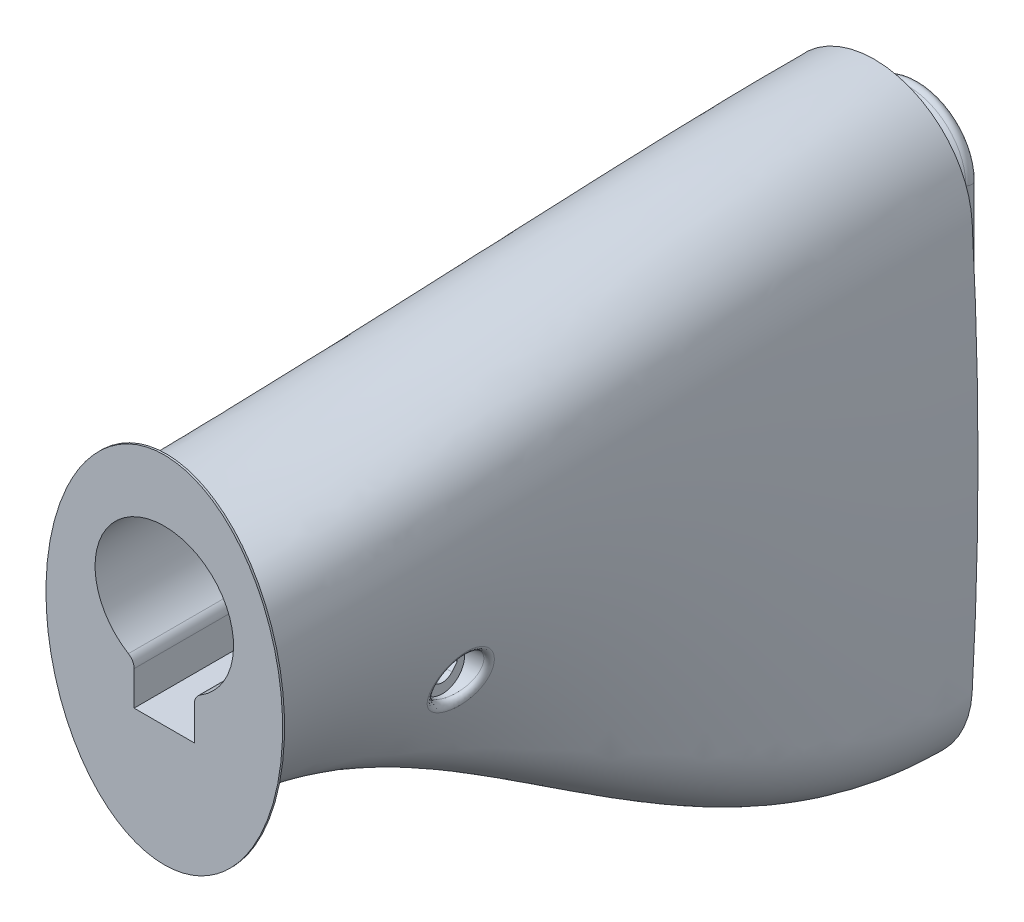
SolidWorks part; units mm, degrees
ref_plane "Front Plane" through (0, 0, 0) normal (0, 0, 1) x (1, 0, 0)
ref_plane "Top Plane" through (0, 0, 0) normal (0, 1, 0) x (1, 0, 0)
ref_plane "Right Plane" through (0, 0, 0) normal (1, 0, 0) x (0, 0, -1)
sketch "Sketch1" plane through (0, 0, 0) normal (0, 0, 1) x (1, 0, 0)
  line L0 (0, 37.2523) -> (0, -28.9777) construction
  line L1 (-22.225, 1.7278) -> (-22.225, 17.909) construction
  arc A0 (-14.2875, 13.501) -> (14.2875, 13.501) centre (0, -21.8186) cw
  arc A1 (-14.2875, 13.501) -> (-22.225, 1.7278) centre (-9.525, 1.7278) ccw
  arc A2 (14.2875, 13.501) -> (22.225, 1.7278) centre (9.525, 1.7278) cw
  arc A3 (-9.9123, -33.3395) -> (9.9123, -33.3395) centre (0, -25.4) ccw
  arc A4 (-22.225, 1.7278) -> (-9.9123, -33.3395) centre (33.8684, 1.7278) ccw
  arc A5 (22.225, 1.7278) -> (9.9123, -33.3395) centre (-33.8684, 1.7278) cw
  dimension "D1" = 12.7
  dimension "D2" = 38.1
  dimension "D3" = 25.4
  dimension "D4" = 44.45
  dimension "D5" = 21.8186
ref_plane "Plane1" through (0, 0, -152.4) normal (0, 0, -1) x (-1, 0, 0)
sketch "Sketch2" plane through (0, 0, -152.4) normal (0, 0, -1) x (-1, 0, 0)
  line L0 (0, 200037.2523) -> (0, -200028.9777) construction
  line L1 (0, 25.4) -> (0, -101.6) construction
  line L2 (-22.225, -38.1) -> (22.225, -38.1) construction
  line L3 (-20.9709, 5.5991) -> (-20.9709, -81.7991) construction
  arc A6 (20.9709, 5.5991) -> (14.2875, 19.7925) centre (0, 4.3945) ccw
  arc A7 (20.9709, -81.7991) -> (20.9709, 5.5991) centre (-739.775, -38.1) ccw
  arc A8 (-20.9709, -81.7991) -> (20.9709, -81.7991) centre (0, -80.5945) ccw
  arc A9 (-20.9709, 5.5991) -> (-20.9709, -81.7991) centre (739.775, -38.1) ccw
  arc A10 (-14.2875, 19.7925) -> (-20.9709, 5.5991) centre (0, 4.3945) ccw
  arc A11 (14.2875, 19.7925) -> (-14.2875, 19.7925) centre (0, 4.3945) ccw
  dimension "D1" = 25.4
  dimension "D2" = 762
  dimension "D4" = 127
  dimension "D5" = 44.45
loft "Loft1" add profiles "Sketch1", "Sketch2"
sketch "Sketch3" plane through (0, 0, 0) normal (0, 0, 1) x (1, 0, 0)
  line L0 (-6.477, -13.373) -> (-6.477, -22.225)
  line L1 (-6.477, -22.225) -> (6.477, -22.225)
  line L2 (6.477, -22.225) -> (6.477, -13.373)
  line L3 (0, -22.225) -> (0, 0) construction
  arc A0 (6.477, -13.373) -> (-6.477, -13.373) centre (0, 0) ccw
  point P11 (0, 14.859)
  dimension "D2" = 14.859
  dimension "D3" = 12.954
  dimension "D4" = 37.084
extrude "Cut-Extrude1" cut sketch "Sketch3" against normal blind 91.44
sketch "Sketch4" plane through (0, 0, 0) normal (1, 0, 0) x (0, 0, -1)
  line L1 (91.44, -22.225) -> (0, -22.225) construction
  circle A0 centre (45.72, -22.225) radius 25.4
  dimension "D1" = 50.8
extrude "Cut-Extrude2" cut sketch "Sketch4" against normal mid plane 2.54
sketch "Sketch5" plane through (0, 0, 0) normal (1, 0, 0) x (0, 0, -1)
  line L0 (91.44, -22.225) -> (0, -22.225) construction
  line L1 (47.763, -25.7177) -> (48.895, -27.0667)
  line L2 (48.895, -27.0667) -> (48.895, -27.7973)
  line L3 (48.895, -27.7973) -> (47.763, -29.1463)
  line L4 (45.72, -27.432) -> (48.895, -27.432) construction
  arc A0 (47.763, -25.7177) -> (47.763, -29.1463) centre (45.72, -27.432) ccw
  circle A1 centre (45.72, -27.432) radius 2.667 construction
  circle A2 centre (45.72, -22.225) radius 25.4
  circle A3 centre (45.72, -22.225) radius 25.4 construction
  point P2 (45.72, -24.765)
  point P13 (48.387, -27.432)
  dimension "D1" = 5.334
  dimension "D4" = 0.508
  dimension "D2" = 2.54
  dimension "D5" = 100
  dimension "D3" = 0
extrude "Cut-Extrude3" cut sketch "Sketch5" against normal through all both and the other way through all
ref_plane "Plane2" through (13.97, 0, 0) normal (1, 0, 0) x (0, 0, -1)
ref_plane "Plane3" through (-13.97, 0, 0) normal (-1, 0, 0) x (0, 0, 1)
sketch "Sketch6" plane through (13.97, 0, 0) normal (1, 0, 0) x (0, 0, -1)
  circle A0 centre (45.72, -27.432) radius 4.7625
  dimension "D1" = 9.525
extrude "Cut-Extrude4" cut sketch "Sketch6" along normal through all draft 5
sketch "Sketch7" plane through (-13.97, 0, 0) normal (-1, 0, 0) x (0, 0, 1)
  line L1 (-51.2926, -27.432) -> (-48.5063, -32.258)
  line L2 (-48.5063, -32.258) -> (-42.9337, -32.258)
  line L3 (-42.9337, -32.258) -> (-40.1474, -27.432)
  line L4 (-40.1474, -27.432) -> (-42.9337, -22.606)
  line L5 (-42.9337, -22.606) -> (-48.5063, -22.606)
  line L6 (-48.5063, -22.606) -> (-51.2926, -27.432)
  circle A0 centre (-45.72, -27.432) radius 4.826 construction
  dimension "D1" = 9.652
extrude "Cut-Extrude5" cut sketch "Sketch7" along normal through all draft 5
sketch "Sketch8" plane through (0, 0, 0) normal (1, 0, 0) x (0, 0, -1)
  line L0 (91.44, 14.859) -> (0, 14.859)
  line L1 (91.44, 14.859) -> (0, 14.859) construction
  line L2 (0, 0) -> (91.44, 0) construction
  line L3 (91.44, 14.859) -> (106.299, 0)
  line L4 (106.299, 0) -> (91.44, 0)
  line L5 (91.44, 14.859) -> (91.44, 0)
  dimension "D1" = 45
revolve "Cut-Revolve1" cut sketch "Sketch8" angle 360 about L2
sketch "Sketch9" plane through (0, -22.225, 0) normal (0, 1, 0) x (1, 0, 0)
  line L0 (-6.477, 91.44) -> (6.477, 91.44)
  line L1 (6.477, 91.44) -> (0, 97.917)
  line L2 (0, 97.917) -> (-6.477, 91.44)
  dimension "D1" = 90
extrude "Cut-Extrude6" cut sketch "Sketch9" along normal up to next
fillet "Fillet1" radius 1.27 7 edges at (18.0535, -26.0538, -40.7892)
fillet "Fillet2" radius 1.27 2 edges at (1.27, -47.625, -45.72) (-1.27, -47.625, -45.72)
fillet "Fillet3" radius 1.27 6 edges at (0.898, -22.225, -70.748) (0.898, -22.225, -20.692) (-0.898, -22.225, -70.748) (-0.898, -22.225, -20.692) (-1.27, -22.225, -45.72) (1.27, -22.225, -45.72)
fillet "Fillet4" radius 2.54 3 edges at (6.477, -17.799, -91.44) (0, 14.859, -91.44) (-6.477, -17.799, -91.44)
fillet "Fillet5" radius 2.54 6 edges at (-6.477, -13.373, -45.1939) (-6.1935, -13.1942, -91.554) (6.1935, -13.1942, -91.554) (6.477, -13.373, -45.1939)
sketch "Sketch10" plane through (0, 0, -152.4) normal (0, 0, -1) x (-1, 0, 0)
  line L0 (0, 4.3945) -> (0, -80.5945) construction
  line L1 (12.7, 4.3945) -> (12.7, -80.5945)
  line L2 (-12.7, 4.3945) -> (-12.7, -80.5945)
  arc A0 (12.7, 4.3945) -> (-12.7, 4.3945) centre (0, 4.3945) ccw
  arc A1 (-12.7, -80.5945) -> (12.7, -80.5945) centre (0, -80.5945) ccw
  arc A4 (14.2875, 19.7925) -> (-14.2875, 19.7925) centre (0, 4.3945) ccw construction
  arc A5 (-20.9709, -81.7991) -> (20.9709, -81.7991) centre (0, -80.5945) ccw construction
  point P3 (0, -38.1)
  dimension "D1" = 25.4
extrude "Boss-Extrude1" add sketch "Sketch10" along normal blind 12.7
ref_plane "Plane4" through (0, -80.5945, 0) normal (0, -1, 0) x (-1, 0, 0)
sketch "Sketch11" plane through (0, -80.5945, 0) normal (0, -1, 0) x (-1, 0, 0)
  line L0 (-12.7, 165.1) -> (-12.7, 152.4) construction
  line L1 (-10.4549, 157.8201) -> (-12.328, 159.6932)
  line L2 (20.9709, 152.4) -> (-20.9709, 152.4) construction
  line L4 (-11.43, 161.8612) -> (0, 161.8612)
  line L5 (0, 161.8612) -> (0, 165.1)
  line L6 (0, 165.1) -> (-19.05, 165.1)
  line L7 (-19.05, 165.1) -> (-19.05, 152.4)
  line L8 (-19.05, 152.4) -> (-12.7, 152.4)
  line L9 (12.7, 165.1) -> (-12.7, 165.1) construction
  line L10 (-9.9504, 153.9875) -> (-10.8669, 152.4)
  line L11 (-12.7, 152.4) -> (-10.8669, 152.4)
  line L12 (12.7, 152.4) -> (-12.7, 152.4) construction
  arc A0 (-10.4549, 157.8201) -> (-9.9504, 153.9875) centre (-12.7, 155.575) cw
  arc A1 (-12.328, 159.6932) -> (-11.43, 161.8612) centre (-11.43, 160.5912) cw
  point P9 (-12.7, 158.75)
  dimension "D1" = 45
  dimension "D2" = 1.27
  dimension "D3" = 6.35
  dimension "D4" = 60
sketch "Sketch12" plane through (0, 0, -152.4) normal (0, 0, -1) x (-1, 0, 0)
  line L2 (12.7, -80.5945) -> (12.7, 4.3945)
  line L3 (-12.7, 4.3945) -> (-12.7, -80.5945)
  line L4 (12.7, -80.5945) -> (12.7, 4.3945)
  line L5 (-12.7, 4.3945) -> (-12.7, -80.5945)
  arc A2 (-12.7, -80.5945) -> (12.7, -80.5945) centre (0, -80.5945) ccw
  arc A3 (12.7, 4.3945) -> (-12.7, 4.3945) centre (0, 4.3945) ccw
  arc A4 (-12.7, -80.5945) -> (12.7, -80.5945) centre (0, -80.5945) ccw
  arc A5 (12.7, 4.3945) -> (-12.7, 4.3945) centre (0, 4.3945) ccw
  dimension "D1" = 0
sweep "Cut-Sweep1" cut profiles "Sketch11" path "Sketch12"
sketch "Sketch15" plane through (0, 0, -161.8612) normal (0, 0, -1) x (-1, 0, 0)
  line L0 (0, 4.3945) -> (0, -80.5945) construction
  line L1 (4.7625, 4.3945) -> (4.7625, -80.5945)
  line L2 (-4.7625, 4.3945) -> (-4.7625, -80.5945)
  arc A0 (4.7625, 4.3945) -> (-4.7625, 4.3945) centre (0, 4.3945) ccw
  arc A1 (-4.7625, -80.5945) -> (4.7625, -80.5945) centre (0, -80.5945) ccw
  arc A3 (11.43, 4.3945) -> (-11.43, 4.3945) centre (0, 4.3945) ccw construction
  arc A4 (-11.43, -80.5945) -> (11.43, -80.5945) centre (0, -80.5945) ccw construction
  point P3 (0, -38.1)
  point P8 (0, 6.2482)
  dimension "D1" = 9.525
extrude "Cut-Extrude8" cut sketch "Sketch15" against normal blind 3.175
sketch "Sketch16" plane through (0, 0, 0) normal (1, 0, 0) x (0, 0, -1)
  line L0 (161.8612, -38.1) -> (152.4, -38.1)
  line L1 (161.8612, -80.5945) -> (161.8612, 4.3945) construction
  line L2 (74.7786, -68.9769) -> (94.0487, -81.3867) construction
  line L3 (84.4136, -75.1818) -> (104.006, -44.7585) construction
  line L4 (152.4, -81.7991) -> (152.4, 5.5991) construction
  arc A0 (152.4, -38.1) -> (84.4136, -75.1818) centre (152.4, -118.9645) ccw
  spline S0 degree 3 poles (0, -38.1001) (0.2943, -38.1011) (0.8618, -38.1031) (1.6811, -38.1184) (2.4369, -38.1402) (3.1298, -38.1672) (4.5176, -38.234) (6.0008, -38.3408) (7.3856, -38.4763) (7.9433, -38.5359) (8.9702, -38.6503) (10.652, -38.8687) (12.6527, -39.1906) (14.3506, -39.5038) (16.1253, -39.8631) (18.2637, -40.3506) (21.5418, -41.1987) (25.5906, -42.4269) (30.4074, -44.1568) (35.1769, -46.1159) (39.9038, -48.2808) (44.5932, -50.6283) (49.2498, -53.1351) (53.8784, -55.7781) (58.484, -58.5339) (63.0711, -61.3794) (67.6447, -64.2915) (72.2094, -67.247) (76.6706, -70.1579) (80.3779, -72.5744) (83.3284, -74.4846) (85.6181, -75.9567) (87.9975, -77.4724) (91.1439, -79.4522) (95.0616, -81.8631) (99.6764, -84.5952) (104.3116, -87.2062) (108.9759, -89.6754) (113.6742, -91.9795) (118.4113, -94.0951) (123.1922, -95.9991) (128.0217, -97.668) (132.9047, -99.0783) (137.0236, -100.0186) (140.3444, -100.6169) (142.8524, -100.9866) (145.3499, -101.2709) (147.3829, -101.434) (149.079, -101.5279) (150.6006, -101.5871) (151.7538, -101.596) (152.4, -101.6009) knots 0 0 0 0 0.00527 0.010159 0.014672 0.018809 0.022574 0.039548 0.04543 0.047486 0.049589 0.06393 0.077846 0.085868 0.094841 0.110265 0.125131 0.155461 0.185979 0.216734 0.247753 0.279048 0.310613 0.34243 0.374473 0.406703 0.439078 0.471551 0.504068 0.534455 0.550784 0.567002 0.583193 0.601295 0.633563 0.665553 0.697309 0.728808 0.760033 0.790985 0.821677 0.852143 0.882437 0.912635 0.92774 0.942844 0.958017 0.972738 0.979353 0.98843 1 1 1 1 construction
  spline S1 degree 3 poles (-432.9519, -939.5104) (189.964, 1057.6711) (-37.5642, -1197.3685) (585.3496, 799.8025) knots -1.530404 -1.530404 -1.530404 -1.530404 2.530399 2.530399 2.530399 2.530399 only from (0, -38.1) to (152.4, -101.6005)
  spline S2 degree 3 poles (662.9124, -834.4695) (235.6818, 943.1779) (-83.278, -901.4893) (-510.5078, 876.132) knots -3.175495 -3.175495 -3.175495 -3.175495 4.175469 4.175469 4.175469 4.175469 only from (152.4, 25.4003) to (0, 16.2814)
  spline S4 degree 3 poles (0, -38.1) (55.0334, -38.0999) (97.3666, -101.6006) (152.4, -101.6005) knots 0 0 0 0 1 1 1 1 construction
  point P6 (130.8015, -38.1)
  point P16 (112.162, -92.1733)
  point P17 (137.4137, -38.1)
  point P18 (152.4, -38.1)
sketch "Sketch17" plane through (0, 0, -158.6862) normal (0, 0, -1) x (-1, 0, 0)
  line L0 (0, -38.1) -> (0, -75.1818) construction
  circle A0 centre (0, -38.1) radius 4.7625
  point P2 (0, -38.1)
  point P5 (0, -38.1)
  dimension "D1" = 9.525
sweep "Cut-Sweep2" cut profiles "Sketch17" path "Sketch16"
sketch "Sketch18" plane through (0, 0, 0) normal (1, 0, 0) x (0, 0, -1)
  line L0 (106.299, 0) -> (139.8698, 0) construction
  line L1 (116.9742, -46.2728) -> (159.3055, -25.643) construction
  arc A0 (106.299, 0) -> (116.9742, -46.2728) centre (106.299, -24.3678) cw
  arc A1 (152.4, -38.1) -> (84.4136, -75.1818) centre (152.4, -118.9645) ccw construction
  point P4 (0, 0)
  point P12 (144.3658, 3.0606)
  point P13 (117.8591, -46.0686)
ref_plane "Plane5" through (0, 0, -106.299) normal (0, 0, 1) x (1, 0, 0)
sketch "Sketch19" plane through (0, 0, -106.299) normal (0, 0, 1) x (1, 0, 0)
  circle A0 centre (0, 0) radius 4.7625
  dimension "D1" = 9.525
sweep "Cut-Sweep3" cut profiles "Sketch19" path "Sketch18"
fillet "Fillet7" radius 1.27 2 edges at (4.7169, -75.0579, -85.2865) (-4.6765, -1.1114, -101.4923)
fillet "Fillet8" radius 1.27 12 edges at (0, -85.357, -161.8612) (4.7625, -38.1, -161.8612) (0, 9.157, -161.8612) (0, -33.3375, -158.6862) (0, -42.8625, -158.6862) (-4.7625, -59.3472, -158.6862) (0, -85.357, -158.6862) (4.7625, -59.3472, -158.6862) (4.7625, -16.8528, -158.6862) (0, 9.157, -158.6862) (-4.7625, -38.1, -161.8612) (-4.7625, -16.8528, -158.6862)
sketch "Sketch13" plane through (0, 0, 0) normal (0, 0, 1) x (1, 0, 0)
  line L4 (-6.477, -13.373) -> (-6.477, -22.225)
  line L5 (-6.477, -22.225) -> (6.477, -22.225)
  line L6 (6.477, -22.225) -> (6.477, -13.373)
  line L7 (-6.477, -14.8802) -> (-6.477, -22.225)
  line L8 (-6.477, -22.225) -> (6.477, -22.225)
  line L9 (6.477, -22.225) -> (6.477, -14.8802)
  arc A0 (6.477, -14.8802) -> (7.7006, -12.7079) centre (9.017, -14.8802) cw
  arc A1 (6.477, -13.373) -> (-6.477, -13.373) centre (0, 0) ccw
  arc A2 (7.7006, -12.7079) -> (-7.7006, -12.7079) centre (0, 0) ccw
  arc A3 (-6.477, -14.8802) -> (-7.7006, -12.7079) centre (-9.017, -14.8802) ccw
  ellipse E0 centre (0, -10.0183) end of major axis (0, -48.1183) minor radius 25.4
  dimension "D2" = 2.54
  dimension "D3" = 76.2
  dimension "D4" = 50.8
  dimension "D1" = 0
extrude "Boss-Extrude2" add sketch "Sketch13" against normal blind 0.4064
sketch "Sketch22" plane through (0, 0, -158.6862) normal (0, 0, -1) x (-1, 0, 0)
  line L0 (-1.6477, 1.1014) -> (-1.6477, -83.7739) construction
  text T0 "HOFFMAN             TACTICAL" font "Arial Rounded MT Bold" height 3.175
  point P0 (-1.6477, 1.1014)
  point P3 (-1.7286, 4.3945)
  point P4 (0, 0)
extrude "Cut-Extrude9" cut sketch "Sketch22" against normal blind 0.4064
